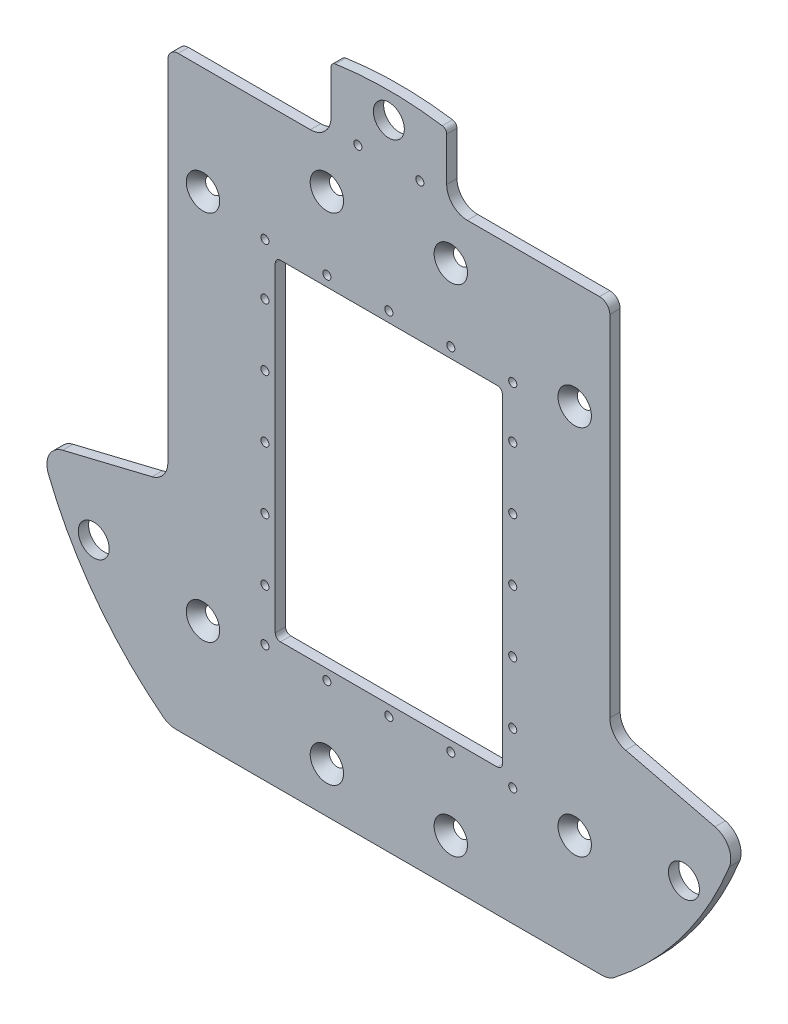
SolidWorks part; units mm, degrees
ref_plane "Front" through (0, 0, 0) normal (0, 0, 1) x (1, 0, 0)
ref_plane "Top" through (0, 0, 0) normal (0, 1, 0) x (1, 0, 0)
ref_plane "Right" through (0, 0, 0) normal (1, 0, 0) x (0, 0, -1)
sketch "Sketch1" plane through (0, 0, 0) normal (0, 0, 1) x (1, 0, 0)
  line L0 (0, 209.55) -> (0, 0) construction
  line L1 (0, 0) -> (181.4756, -104.775) construction
  line L2 (0, 0) -> (-181.4756, -104.775) construction
  line L3 (-25.4, 209.55) -> (25.4, 209.55) construction
  line L4 (168.7756, -126.772) -> (194.1756, -82.778) construction
  line L5 (-194.1756, -82.778) -> (-168.7756, -126.772) construction
  line L6 (182.1167, -84.6146) -> (164.3367, -115.4104) construction
  line L7 (-127, -171.45) -> (127, -171.45) construction
  line L8 (-127, -171.45) -> (-127, 171.45) construction
  line L9 (-127, 171.45) -> (127, 171.45) construction
  line L10 (127, -171.45) -> (127, 171.45) construction
  line L11 (0, 171.45) -> (0, -171.45) construction
  line L12 (-127, 0) -> (127, 0) construction
  line L13 (182.1167, -84.6146) -> (198.6145, -94.1396) construction
  line L14 (164.3367, -115.4104) -> (180.8345, -124.9354) construction
  line L15 (198.6145, -94.1396) -> (180.8345, -124.9354) construction
  line L16 (182.1167, -84.6146) -> (180.8345, -124.9354) construction
  line L17 (164.3367, -115.4104) -> (198.6145, -94.1396) construction
  line L18 (-181.4756, -104.775) -> (-195.2238, -112.7125) construction
  line L19 (-88.9, 133.35) -> (88.9, 133.35) construction
  line L20 (-88.9, 133.35) -> (-88.9, -133.35) construction
  line L21 (-88.9, -133.35) -> (88.9, -133.35) construction
  line L22 (88.9, 133.35) -> (88.9, -133.35) construction
  line L23 (181.4756, -104.775) -> (195.2238, -112.7125) construction
  line L24 (0, 209.55) -> (0, 225.425) construction
  line L25 (-25.4, 200.025) -> (-25.4, 219.075) construction
  line L26 (25.4, 200.025) -> (25.4, 219.075) construction
  line L27 (-177.0245, -131.5345) -> (-160.5267, -122.0095) construction
  line L28 (-202.4245, -87.5405) -> (-185.9267, -78.0155) construction
  circle A0 centre (0, 0) radius 225.425 construction
  circle A1 centre (0, 0) radius 209.55 construction
  circle A2 centre (0, 0) radius 225.425
  point P4 (0, 209.55)
  point P11 (0, 209.55)
  point P14 (181.4756, -104.775)
  point P17 (-181.4756, -104.775)
  point P28 (0, 133.35)
  point P29 (88.9, 0)
  point P36 (-25.4, 209.55)
  point P39 (25.4, 209.55)
  point P42 (-168.7756, -126.772)
  point P45 (-194.1756, -82.778)
  dimension "D1" = 450.85
  dimension "D2" = 419.1
  dimension "D14" = 450.85
  dimension "D3" = 120
  dimension "D4" = 120
  dimension "D5" = 50.8
  dimension "D6" = 254
  dimension "D7" = 342.9
  dimension "D8" = 19.05
  dimension "D9" = 35.56
  dimension "D10" = 38.1
  dimension "D11" = 38.1
  dimension "D12" = 19.05
  dimension "D13" = 19.05
extrude "Boss-Extrude1" add sketch "Sketch1" along normal mid plane 6.35
hole_wizard "3/4 (0.75) Diameter Hole1" positions "Sketch6" profile "Sketch7" hole size "3/4" standard "ANSI Inch"
sketch "Sketch6" plane through (0, 0, 3.175) normal (0, 0, 1) x (1, 0, 0)
  point P0 (0, 209.55)
  point P3 (181.4756, -104.775)
  point P6 (-181.4756, -104.775)
sketch "Sketch7" plane through (0, 209.55, 3.175) normal (1, 0, 0) x (0, -1, 0)
  line L0 (0, 0) -> (0, 6.35)
  line L1 (0, 6.35) -> (9.525, 6.35)
  line L2 (9.525, 6.35) -> (9.525, 0)
  line L5 (9.525, 0) -> (0, 0)
  line L11 (0, -6.35) -> (0, 107.95) construction
  dimension "Thru Hole Dia." = 19.05
  dimension "Thru Hole Depth" = 6.35
sketch "Sketch9" plane through (0, 0, 0) normal (0, 0, 1) x (1, 0, 0)
  line L0 (0, -50) -> (0, 50) construction
  line L1 (-135.89, 127) -> (-211.7444, 127) construction
  line L2 (-135.89, 127) -> (-135.89, 180.34)
  line L4 (-211.7444, 127) -> (-211.7444, 177.8)
  line L5 (135.89, 127) -> (191.0156, 127) construction
  line L6 (135.89, 127) -> (135.89, 180.34)
  line L8 (191.0156, 127) -> (191.0156, 177.8)
  line L10 (-353.789, -180.34) -> (324.145, -180.34) construction
  line L11 (-353.789, -180.34) -> (-353.789, -268.4716)
  line L12 (-353.789, -268.4716) -> (324.145, -268.4716)
  line L13 (324.145, -180.34) -> (324.145, -268.4716)
  line L14 (-272.128, 127) -> (-135.89, 127) construction
  line L15 (-272.128, 127) -> (-272.128, -69.85)
  line L16 (-272.128, -69.85) -> (-135.89, -69.85) construction
  line L17 (-135.89, 127) -> (-135.89, -69.85) construction
  line L19 (269.7857, 127) -> (269.7857, -69.85)
  line L20 (269.7857, -69.85) -> (135.89, -69.85) construction
  line L21 (135.89, 127) -> (135.89, -69.85) construction
  line L22 (191.0156, 127) -> (269.7857, 127)
  line L24 (-272.128, 127) -> (-211.7444, 127)
  line L25 (-135.89, 127) -> (-135.89, -50.8)
  line L26 (-135.89, -50.8) -> (-214.3301, -69.85)
  line L28 (135.89, 127) -> (135.89, -50.8)
  line L29 (135.89, -50.8) -> (214.3301, -69.85)
  line L31 (-133.35, 224.4055) -> (-211.7444, 177.8)
  line L32 (35.56, 226.8179) -> (137.7906, 226.8179)
  line L33 (35.56, 226.8179) -> (35.56, 180.34)
  line L34 (35.56, 180.34) -> (135.89, 180.34)
  line L36 (-35.56, 224.4055) -> (-133.35, 224.4055)
  line L37 (-35.56, 224.4055) -> (-35.56, 180.34)
  line L38 (-35.56, 180.34) -> (-135.89, 180.34)
  line L40 (191.0156, 177.8) -> (137.7906, 226.8179)
  line L41 (-127, 171.45) -> (127, 171.45) construction
  line L42 (-127, -171.45) -> (127, -171.45) construction
  line L43 (214.3301, -69.85) -> (269.7857, -69.85)
  line L44 (-272.128, -69.85) -> (-214.3301, -69.85)
  line L45 (-353.789, -180.34) -> (324.145, -180.34)
  circle A0 centre (0, 0) radius 225.425 construction
extrude "Cut-Extrude3" cut sketch "Sketch9" along normal through all both and the other way through all
sketch "Sketch3" plane through (0, 0, 3.175) normal (0, 0, 1) x (1, 0, 0)
  line L0 (-88.9, 133.35) -> (-88.9, -133.35) construction
  line L1 (-69.85, -101.6) -> (69.85, -101.6)
  line L2 (-69.85, -101.6) -> (-69.85, 101.6)
  line L3 (-69.85, 101.6) -> (69.85, 101.6)
  line L4 (69.85, -101.6) -> (69.85, 101.6)
  line L5 (0, 101.6) -> (0, -101.6) construction
  line L6 (-69.85, 0) -> (69.85, 0) construction
  line L7 (-88.9, 133.35) -> (88.9, 133.35) construction
  point P0 (0, 0)
  dimension "D1" = 139.7
  dimension "D2" = 203.2
  dimension "D3" = 19.05
  dimension "D4" = 31.75
extrude "Cut-Extrude2" cut sketch "Sketch3" against normal through all
sketch "Sketch10" plane through (0, 0, 0) normal (0, 0, 1) x (1, 0, 0)
  line L0 (-114.3, 152.4) -> (-114.3, -152.4) construction
  line L1 (35.56, 180.34) -> (135.255, 180.34) construction
  line L2 (0, 209.55) -> (0, 0) construction
  line L3 (114.3, 152.4) -> (114.3, -152.4) construction
  line L4 (138.577, -177.8) -> (-138.577, -177.8) construction
  line L5 (-114.3, 152.4) -> (114.3, 152.4) construction
  line L6 (-114.3, -152.4) -> (114.3, -152.4) construction
  line L7 (0, 257.0008) -> (0, -221.5285) construction
  point P4 (114.3, -76.2)
  point P5 (-114.3, -76.2)
  point P6 (-114.3, 114.3)
  point P7 (-114.3, 76.2)
  point P8 (-114.3, 38.1)
  point P9 (-114.3, 0)
  point P10 (-114.3, -38.1)
  point P11 (-114.3, -114.3)
  point P13 (-114.3, -114.3)
  point P15 (114.3, 76.2)
  point P16 (114.3, 38.1)
  point P19 (114.3, 114.3)
  point P20 (-76.2, 152.4)
  point P21 (114.3, 0)
  point P22 (114.3, -38.1)
  point P23 (114.3, -114.3)
  point P24 (114.3, -114.3)
  point P25 (0, 152.4)
  point P26 (-38.1, 152.4)
  point P27 (38.1, 152.4)
  point P28 (76.2, 152.4)
  point P29 (38.1, -152.4)
  point P30 (-76.2, -152.4)
  point P31 (0, -152.4)
  point P32 (-38.1, -152.4)
  point P33 (76.2, -152.4)
hole_wizard "CSK for 5/16 Flat Head Machine Screw1" positions "Sketch11" profile "Sketch12" countersink size "5/16" standard "ANSI Inch"
sketch "Sketch11" plane through (0, 0, 3.175) normal (0, 0, 1) x (1, 0, 0)
  point P0 (-38.1, 152.4)
  point P3 (38.1, 152.4)
  point P6 (-114.3, 114.3)
  point P12 (114.3, 114.3)
  point P18 (-38.1, -152.4)
  point P21 (38.1, -152.4)
  point P33 (-114.3, -114.3)
  point P38 (114.3, -114.3)
sketch "Sketch12" plane through (-38.1, 152.4, 3.175) normal (1, 0, 0) x (0, -1, 0)
  line L0 (0, 0) -> (0, 6.35)
  line L1 (0, 6.35) -> (4.1021, 6.35)
  line L2 (4.1021, 6.35) -> (4.1021, 7.0982)
  line L3 (4.1021, 7.0982) -> (10.2725, 0)
  line L5 (10.2725, 0) -> (0, 0)
  line L6 (-4.1021, 7.0982) -> (-10.2725, 0) construction
  line L11 (0, -6.35) -> (0, 107.95) construction
  dimension "Thru Hole Dia." = 8.2042
  dimension "Thru Hole Depth" = 6.35
  dimension "Near C'Sink Dia." = 20.545
  dimension "Near C'Sink Angle" = 82
sketch "Sketch14" plane through (0, 0, 0) normal (0, 0, 1) x (1, 0, 0)
  line L0 (-69.85, 101.6) -> (-69.85, -101.6) construction
  line L1 (-76.2, 107.95) -> (76.2, 107.95) construction
  line L2 (-76.2, 107.95) -> (-76.2, -107.95) construction
  line L3 (-76.2, -107.95) -> (76.2, -107.95) construction
  line L4 (76.2, 107.95) -> (76.2, -107.95) construction
  line L5 (69.85, 101.6) -> (-69.85, 101.6) construction
  line L6 (-19.05, 186.69) -> (19.05, 186.69) construction
  line L7 (-135.255, 180.34) -> (-35.56, 180.34) construction
  point P4 (0, 107.95)
  point P5 (76.2, 0)
  point P6 (-76.2, 38.1)
  point P12 (-76.2, 76.2)
  point P13 (-76.2, -38.1)
  point P14 (-76.2, -76.2)
  point P15 (76.2, -76.2)
  point P16 (76.2, -38.1)
  point P17 (76.2, 38.1)
  point P18 (76.2, 76.2)
  point P19 (76.2, 0)
  point P24 (-76.2, 0)
  point P25 (0, -107.95)
  point P26 (0, 107.95)
  point P27 (-38.1, 107.95)
  point P28 (38.1, 107.95)
  point P29 (-38.1, -107.95)
  point P30 (38.1, -107.95)
  point P37 (0, 186.69)
  dimension "D1" = 6.35
  dimension "D2" = 152.4
  dimension "D3" = 215.9
  dimension "D4" = 6.35
  dimension "D5" = 6.35
  dimension "D6" = 38.1
hole_wizard "#10 Clearance Hole1" positions "Sketch15" profile "Sketch16" hole size "#10" standard "ANSI Inch"
sketch "Sketch15" plane through (0, 0, 3.175) normal (0, 0, 1) x (1, 0, 0)
  line L0 (-76.2, 107.95) -> (76.2, 107.95) construction
  point P0 (-76.2, 76.2)
  point P3 (-76.2, 38.1)
  point P6 (-76.2, 107.95)
  point P9 (-38.1, 107.95)
  point P12 (0, 107.95)
  point P16 (38.1, 107.95)
  point P19 (76.2, 107.95)
  point P22 (76.2, 76.2)
  point P25 (76.2, 38.1)
  point P28 (76.2, 0)
  point P31 (76.2, -38.1)
  point P34 (76.2, -76.2)
  point P37 (76.2, -107.95)
  point P40 (38.1, -107.95)
  point P43 (0, -107.95)
  point P46 (-38.1, -107.95)
  point P49 (-76.2, -107.95)
  point P52 (-76.2, -76.2)
  point P55 (-76.2, -38.1)
  point P58 (-76.2, 0)
  point P62 (19.05, 186.69)
  point P65 (-19.05, 186.69)
sketch "Sketch16" plane through (-76.2, 76.2, 3.175) normal (1, 0, 0) x (0, -1, 0)
  line L0 (0, 0) -> (0, 6.35)
  line L1 (0, 6.35) -> (2.4892, 6.35)
  line L2 (2.4892, 6.35) -> (2.4892, 0)
  line L5 (2.4892, 0) -> (0, 0)
  line L11 (0, -6.35) -> (0, 107.95) construction
  dimension "Thru Hole Dia." = 4.9784
  dimension "Thru Hole Depth" = 6.35
fillet "Fillet4" radius 3.175 6 edges at (-69.85, -101.6, 0) (-69.85, 101.6, 0) (69.85, 101.6, 0) (69.85, -101.6, 0) (35.56, 222.6026, 0) (-35.56, 222.6026, 0)
fillet "Fillet5" radius 12.7 8 edges at (-135.89, -50.8, 0) (-35.56, 180.34, 0) (35.56, 180.34, 0) (135.89, -50.8, 0) (214.3301, -69.85, 0) (-135.255, -180.34, 0) (135.255, -180.34, 0) (-214.3301, -69.85, 0)
sketch "Sketch13" plane through (0, 0, 0) normal (0, 0, 1) x (1, 0, 0)
  line L0 (48.26, 180.34) -> (135.255, 180.34) construction
  line L1 (135.89, 179.862) -> (135.89, -40.8152) construction
  line L2 (129.54, 180.34) -> (135.89, 180.34)
  line L3 (135.89, 180.34) -> (135.89, 173.99)
  line L4 (-135.255, 180.34) -> (-48.26, 180.34) construction
  line L5 (-135.89, -40.8152) -> (-135.89, 179.862) construction
  line L6 (-135.89, 173.99) -> (-135.89, 180.34)
  line L7 (-135.89, 180.34) -> (-129.54, 180.34)
  arc A0 (129.54, 180.34) -> (135.89, 173.99) centre (129.54, 173.99) cw
  arc A1 (-129.54, 180.34) -> (-135.89, 173.99) centre (-129.54, 173.99) ccw
  dimension "D1" = 6.35
  dimension "D2" = 6.35
extrude "Cut-Extrude4" cut sketch "Sketch13" against normal through all both and the other way through all
equation "\"var\"= 1in"
equation "\"D9@Sketch9\"=\"D8@Sketch9\""
equation "\"D2@Sketch9\"=\"D1@Sketch9\""
equation "\"D21@Sketch10\"=\"D11@Sketch10\""
